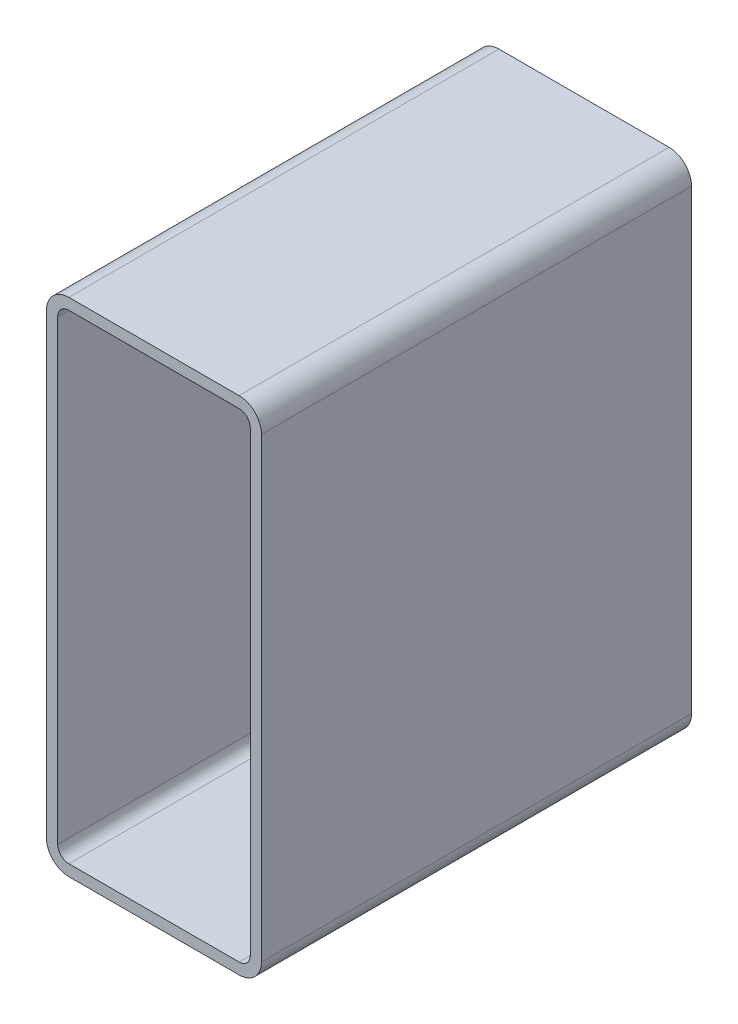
SolidWorks part; units mm, degrees
ref_plane "Front Plane" through (0, 0, 0) normal (0, 0, 1) x (1, 0, 0)
ref_plane "Top Plane" through (0, 0, 0) normal (0, 1, 0) x (1, 0, 0)
ref_plane "Right Plane" through (0, 0, 0) normal (1, 0, 0) x (0, 0, -1)
sketch "Sketch1" plane through (0, 0, 0) normal (0, 0, 1) x (1, 0, 0)
sketch_block_instance "HSS14x6x0.3125-1"
sketch_block "HSS14x6x0.3125"
extrude "Boss-Extrude1" add sketch "Sketch1" along normal blind 304.8
